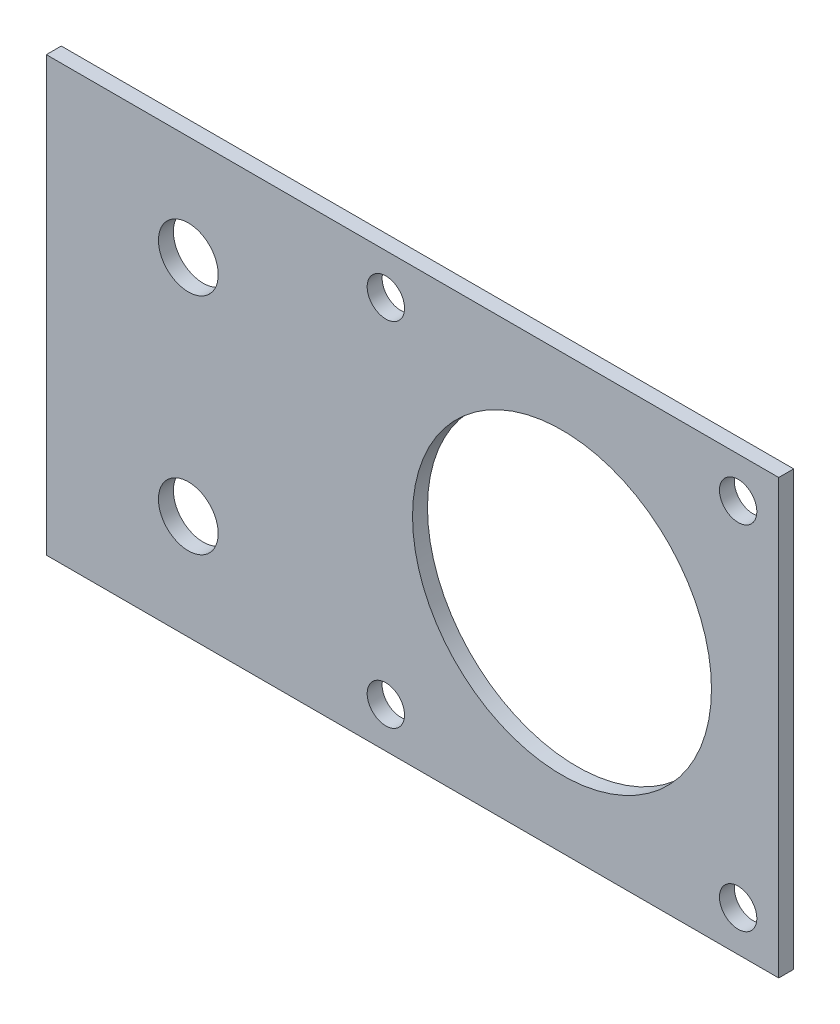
SolidWorks part; units mm, degrees
ref_plane "Alzado" through (0, 0, 0) normal (0, 0, 1) x (1, 0, 0)
ref_plane "Planta" through (0, 0, 0) normal (0, 1, 0) x (1, 0, 0)
ref_plane "Vista lateral" through (0, 0, 0) normal (1, 0, 0) x (0, 0, -1)
sketch "Croquis1" plane through (0, 0, 0) normal (0, 0, 1) x (1, 0, 0)
  line L1 (-69, 29) -> (29, 29)
  line L2 (-69, 29) -> (-69, -29)
  line L3 (-69, -29) -> (29, -29)
  line L4 (29, 29) -> (29, -29)
  circle A0 centre (0, 0) radius 20
extrude "Extruir1" add sketch "Croquis1" along normal blind 2
hole_wizard "Diámetro de taladro Ø5.0 (5)1" positions "Croquis3" profile "Croquis2" hole size "Ø5.0" standard "ISO"
sketch "Croquis3" plane through (0, 0, 2) normal (0, 0, 1) x (1, 0, 0)
  point P0 (23.57, 23.57)
  point P1 (-23.57, 23.57)
  point P3 (23.57, -23.57)
  point P5 (-23.57, -23.57)
sketch "Croquis2" plane through (23.57, 23.57, 2) normal (1, 0, 0) x (0, -1, 0)
  line L0 (0, 0) -> (0, 2)
  line L1 (0, 2) -> (2.5, 2)
  line L2 (2.5, 2) -> (2.5, 0)
  line L5 (2.5, 0) -> (0, 0)
  line L11 (0, -6.35) -> (0, 107.95) construction
  dimension "Diámetro de taladro hasta el siguiente" = 5
  dimension "Profundidad de taladro hasta el siguiente" = 2
hole_wizard "Diámetro de taladro Ø8.0 (8)1" positions "Croquis3D1" profile "Croquis4" hole size "Ø8.0" standard "ISO"
sketch3d "Croquis3D1"
  point P0 (-50, 15, 2)
  point P2 (-50, -15, 2)
sketch "Croquis4" plane through (-50, 15, 2) normal (1, 0, 0) x (0, -1, 0)
  line L0 (0, 0) -> (0, 2)
  line L1 (0, 2) -> (4, 2)
  line L2 (4, 2) -> (4, 0)
  line L5 (4, 0) -> (0, 0)
  line L11 (0, -6.35) -> (0, 107.95) construction
  dimension "Diámetro de taladro hasta el siguiente" = 8
  dimension "Profundidad de taladro hasta el siguiente" = 2
